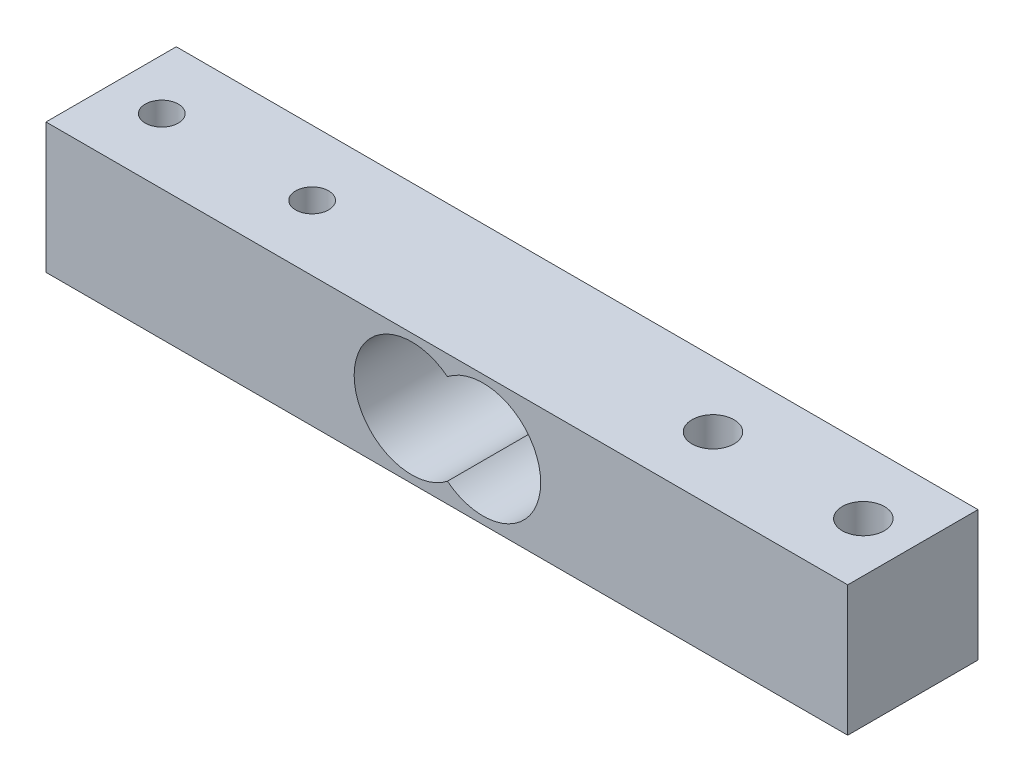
SolidWorks part; units mm, degrees
ref_plane "Front Plane" through (0, 0, 0) normal (0, 0, 1) x (1, 0, 0)
ref_plane "Top Plane" through (0, 0, 0) normal (0, 1, 0) x (1, 0, 0)
ref_plane "Right Plane" through (0, 0, 0) normal (1, 0, 0) x (0, 0, -1)
sketch "Sketch1" plane through (0, 0, 0) normal (0, 0, 1) x (1, 0, 0)
  line L1 (-40, -6.5) -> (40, -6.5)
  line L2 (-40, -6.5) -> (-40, 6.5)
  line L3 (-40, 6.5) -> (40, 6.5)
  line L4 (40, -6.5) -> (40, 6.5)
  line L5 (-40, -6.5) -> (40, 6.5) construction
  line L6 (-40, 6.5) -> (40, -6.5) construction
  arc A0 (0.056, 4.5186) -> (0.056, -4.5186) centre (-3.5, 0) ccw
  arc A3 (0.056, -4.5186) -> (0.056, 4.5186) centre (3.612, 0) ccw
  point P0 (0, 0)
  dimension "D3" = 3.5
  dimension "D4" = 11.5
  dimension "D1" = 80
  dimension "D2" = 13
extrude "Boss-Extrude1" add sketch "Sketch1" along normal blind 13
sketch "Sketch2" plane through (0, 6.5, 0) normal (0, 1, 0) x (1, 0, 0)
  line L0 (40, -6.5) -> (-40, -6.5) construction
  line L1 (-40, -13) -> (-40, 0) construction
  line L2 (0.056, -13) -> (0.056, 0) construction
  line L3 (-34.944, 0) -> (-34.944, -13) construction
  line L4 (40, 0) -> (-40, 0) construction
  line L5 (40, -13) -> (-40, -13) construction
  line L6 (-19.944, 0) -> (-19.944, -13) construction
  line L7 (20.056, 0) -> (20.056, -13) construction
  line L8 (35.056, 0) -> (35.056, -13) construction
  line L9 (40, -13) -> (40, 0) construction
  dimension "D1" = 35
  dimension "D2" = 2
  dimension "D3" = 15
  dimension "D5" = 55
  dimension "D4" = 2
hole_wizard "M5x0.8 Tapped Hole2" positions "Sketch8" profile "Sketch7" tap size "M5x0.8" standard "ANSI Metric"
sketch "Sketch8" plane through (0, 6.5, 0) normal (0, 1, 0) x (1, 0, 0)
  line L0 (20.056, 0) -> (20.056, -13) construction
  line L1 (35.056, 0) -> (35.056, -13) construction
  point P0 (20.056, -6.5)
  point P4 (35.056, -6.5)
sketch "Sketch7" plane through (20.056, 6.5, 6.5) normal (1, 0, 0) x (0, 0, 1)
  line L0 (0, 0) -> (0, 15.2318)
  line L1 (0, 15.2318) -> (2.1, 13.97)
  line L2 (2.1, 13.97) -> (2.1, 0)
  line L5 (2.1, 0) -> (0, 0)
  line L10 (0, 15.2318) -> (-2.1, 13.97) construction
  line L11 (0, -6.35) -> (0, 107.95) construction
  dimension "Tap Drill Dia." = 4.2
  dimension "Tap Drill Depth" = 13.97
  dimension "Drill Angle" = 118
hole_wizard "M4x0.7 Tapped Hole2" positions "Sketch10" profile "Sketch9" tap size "M4x0.7" standard "ANSI Metric"
sketch "Sketch10" plane through (0, 6.5, 0) normal (0, 1, 0) x (1, 0, 0)
  line L0 (-34.944, 0) -> (-34.944, -13) construction
  line L1 (-19.944, 0) -> (-19.944, -13) construction
  point P0 (-34.944, -6.5)
  point P4 (-19.944, -6.5)
sketch "Sketch9" plane through (-34.944, 6.5, 6.5) normal (1, 0, 0) x (0, 0, 1)
  line L0 (0, 0) -> (0, 13)
  line L1 (0, 13) -> (1.65, 13)
  line L2 (1.65, 13) -> (1.65, 0)
  line L5 (1.65, 0) -> (0, 0)
  line L11 (0, -6.35) -> (0, 107.95) construction
  dimension "Thru Tap Drill Dia." = 3.3
  dimension "Thru Tap Drill Depth" = 13
